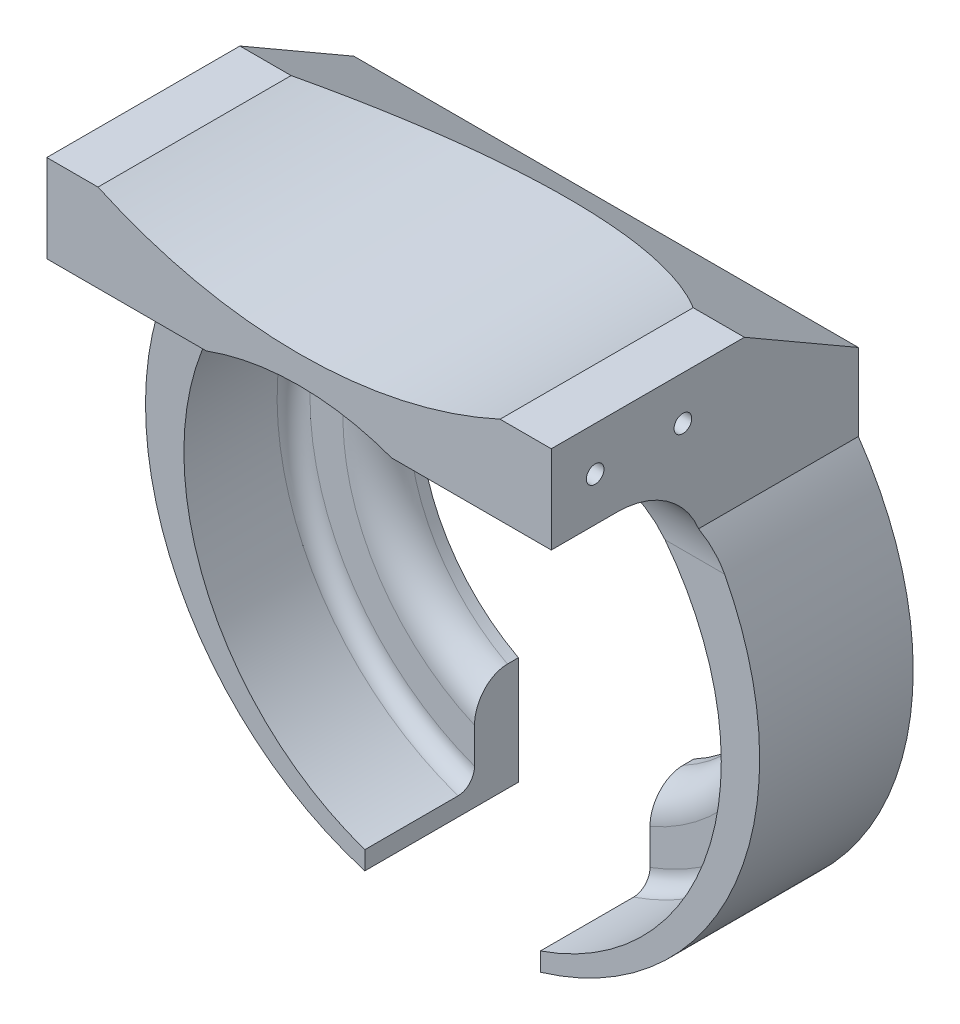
SolidWorks part; units mm, degrees
ref_plane "Front Plane" through (0, 0, 0) normal (0, 0, 1) x (1, 0, 0)
ref_plane "Top Plane" through (0, 0, 0) normal (0, 1, 0) x (1, 0, 0)
ref_plane "Right Plane" through (0, 0, 0) normal (1, 0, 0) x (0, 0, -1)
sketch "Sketch1" plane through (0, 0, 0) normal (0, 0, 1) x (1, 0, 0)
  line L2 (0, 0) -> (0, -82.55) construction
  line L8 (-73.025, 57.0507) -> (-73.025, 98.425)
  line L9 (73.025, 57.0507) -> (73.025, 98.425)
  line L11 (0, 0) -> (0, 98.425) construction
  line L18 (-73.025, 98.425) -> (73.025, 98.425)
  circle A0 centre (0, 0) radius 77.7875
  arc A5 (-73.025, 57.0507) -> (73.025, 57.0507) centre (0, 6.35) ccw
  point P18 (73.025, -69.85)
  point P21 (-73.025, -69.85)
  dimension "D1" = 155.575
  dimension "D2" = 88.9
  dimension "D3" = 180.975
  dimension "D4" = 98.425
  dimension "D5" = 146.05
extrude "Boss-Extrude1" add sketch "Sketch1" along normal blind 88.9
sketch "Sketch2" plane through (0, 0, 0) normal (0, 0, -1) x (-1, 0, 0)
  circle A2 centre (0, 0) radius 77.7875 construction
  circle A3 centre (0, 0) radius 53.975
  circle A4 centre (0, 0) radius 77.7875
  dimension "D2" = 107.95
extrude "Boss-Extrude2" add sketch "Sketch2" against normal blind 12.7
fillet "Fillet7" radius 4.7625 1 edges at (-77.7875, 0, 12.7)
fillet "Fillet8" radius 9.525 1 edges at (-53.975, 0, 12.7)
sketch "Sketch19" plane through (0, 0, 88.9) normal (0, 0, 1) x (1, 0, 0)
  line L0 (0, 0) -> (0, -87.1684) construction
  line L1 (-25.4, -11.8619) -> (25.4, -11.8619)
  line L2 (-25.4, -11.8619) -> (-25.4, -87.1684)
  line L3 (-25.4, -87.1684) -> (25.4, -87.1684)
  line L4 (25.4, -11.8619) -> (25.4, -87.1684)
  dimension "D1" = 50.8
extrude "Cut-Extrude7" cut sketch "Sketch19" against normal through all
hole_wizard "1/4-20 Tapped Hole1" positions "Sketch20" profile "Sketch21" tap size "1/4-20" standard "ANSI Inch"
sketch "Sketch20" plane through (-73.025, 0, 0) normal (-1, 0, 0) x (0, 0, 1)
  line L0 (50.8, 85.725) -> (76.2, 85.725) construction
  line L2 (63.5, 85.725) -> (63.5, 98.425) construction
  line L3 (88.9, 98.425) -> (0, 98.425) construction
  line L4 (88.9, 98.425) -> (88.9, 57.0507) construction
  point P0 (50.8, 85.725)
  point P2 (76.2, 85.725)
  dimension "D1" = 25.4
  dimension "D2" = 12.7
  dimension "D3" = 25.4
sketch "Sketch21" plane through (-73.025, 85.725, 50.8) normal (0, 1, 0) x (0, 0, 1)
  line L0 (0, 0) -> (0, 33.2838)
  line L1 (0, 33.2838) -> (2.5527, 31.75)
  line L2 (2.5527, 31.75) -> (2.5527, 0)
  line L5 (2.5527, 0) -> (0, 0)
  line L10 (0, 33.2838) -> (-2.5527, 31.75) construction
  line L11 (0, -6.35) -> (0, 107.95) construction
  dimension "Tap Drill Dia." = 5.1054
  dimension "Tap Drill Depth" = 31.75
  dimension "Drill Angle" = 118
mirror "Mirror1" about plane through (0, 0, 0) normal (1, 0, 0) of "1/4-20 Tapped Hole1"
sketch "Sketch22" plane through (0, 0, 0) normal (0, 0, -1) x (-1, 0, 0)
  line L0 (0, 98.425) -> (0, 225.425) construction
  line L1 (-73.025, 98.425) -> (73.025, 98.425) construction
  circle A0 centre (0, 225.425) radius 139.7
  point P6 (0, 85.725)
  dimension "D2" = 12.7
  dimension "D1" = 127
extrude "Cut-Extrude8" cut sketch "Sketch22" against normal through all
sketch "Sketch23" plane through (0, 0, 88.9) normal (0, 0, 1) x (1, 0, 0)
  line L0 (-101.6, 77.7875) -> (101.6, 77.7875) construction
  line L1 (101.6, 73.025) -> (101.6, -100.0125)
  line L2 (101.6, -100.0125) -> (-101.6, -100.0125)
  line L3 (-101.6, -100.0125) -> (-101.6, 73.025)
  line L4 (0, 0) -> (0, 73.025) construction
  line L5 (-101.6, 73.025) -> (101.6, 73.025)
  circle A0 centre (0, 0) radius 77.7875 construction
  dimension "D2" = 177.8
  dimension "D3" = 4.7625
  dimension "D4" = 203.2
extrude "Cut-Extrude9" cut sketch "Sketch23" against normal blind 44.45
fillet "Fillet9" radius 25.4 2 edges at (49.9125, 73.025, 44.45) (-49.9125, 73.025, 44.45)
chamfer "Chamfer1" distance 19.05 angle 60 1 edges at (-65.6119, 98.425, 0)
hole_wizard "#8-32 Tapped Hole1" positions "Sketch24" profile "Sketch25" tap size "#8-32" standard "ANSI Inch"
sketch "Sketch24" plane through (0, 0, 0) normal (0, 0, -1) x (-1, 0, 0)
  line L0 (-45, 63.5) -> (45, 63.5) construction
  line L2 (0, 63.5) -> (0, 0) construction
  point P0 (45, 63.5)
  point P2 (-45, 63.5)
  dimension "D1" = 90
  dimension "D2" = 63.5
sketch "Sketch25" plane through (-45, 63.5, 0) normal (1, 0, 0) x (0, 1, 0)
  line L0 (0, 0) -> (0, 22.3738)
  line L1 (0, 22.3738) -> (1.7272, 21.336)
  line L2 (1.7272, 21.336) -> (1.7272, 0)
  line L5 (1.7272, 0) -> (0, 0)
  line L10 (0, 22.3738) -> (-1.7272, 21.336) construction
  line L11 (0, -6.35) -> (0, 107.95) construction
  dimension "Tap Drill Dia." = 3.4544
  dimension "Tap Drill Depth" = 21.336
  dimension "Drill Angle" = 118
